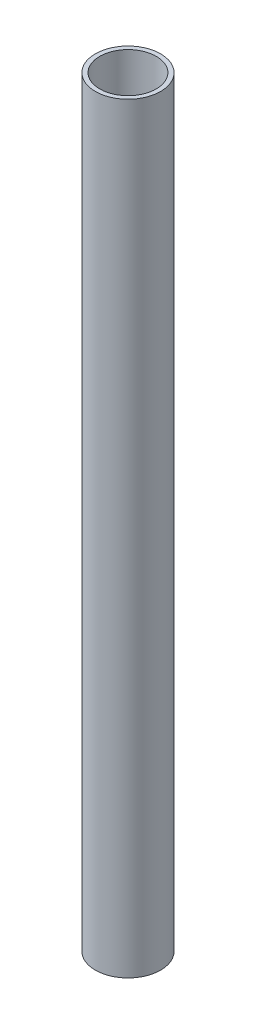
SolidWorks part; units mm, degrees
ref_plane "Plan de face" through (0, 0, 0) normal (0, 0, 1) x (1, 0, 0)
ref_plane "Plan de dessus" through (0, 0, 0) normal (0, 1, 0) x (1, 0, 0)
ref_plane "Plan de droite" through (0, 0, 0) normal (1, 0, 0) x (0, 0, -1)
sketch "Esquisse1" plane through (0, 0, 0) normal (0, 1, 0) x (1, 0, 0)
  circle A0 centre (0, 0) radius 15
  circle A1 centre (0, 0) radius 13
  dimension "D1" = 30
  dimension "D2" = 26
extrude "Extrusion1" add sketch "Esquisse1" along normal blind 350
